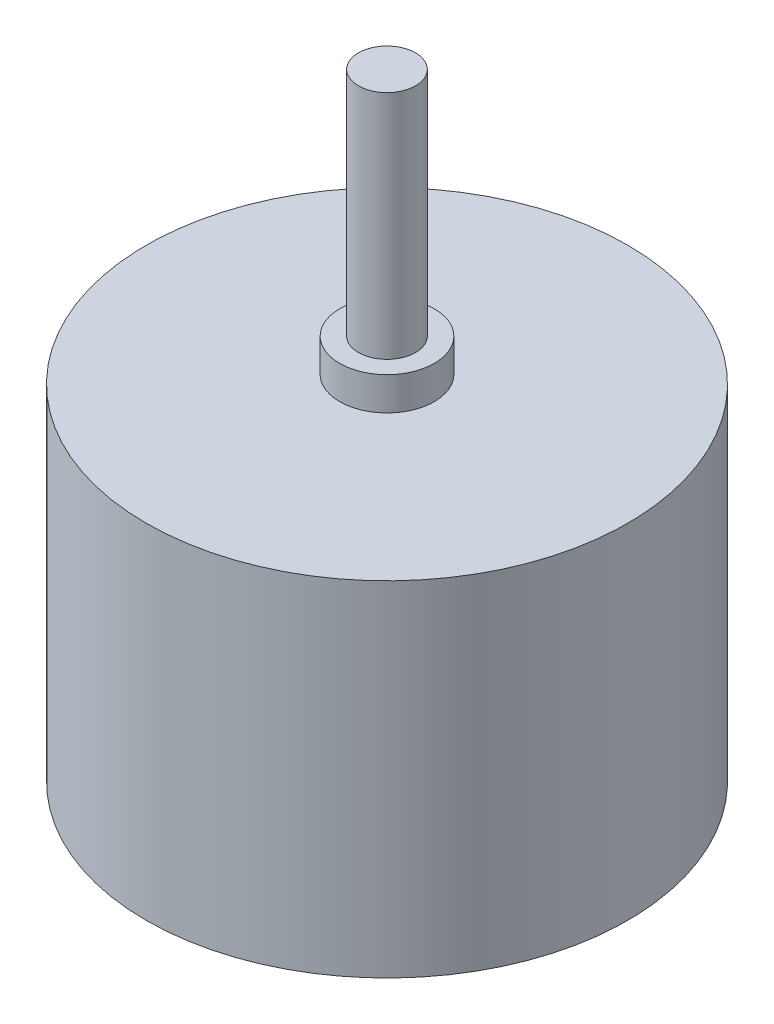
SolidWorks part; units mm, degrees
ref_plane "Front Plane" through (0, 0, 0) normal (0, 0, 1) x (1, 0, 0)
ref_plane "Top Plane" through (0, 0, 0) normal (0, 1, 0) x (1, 0, 0)
ref_plane "Right Plane" through (0, 0, 0) normal (1, 0, 0) x (0, 0, -1)
sketch "Sketch1" plane through (0, 0, 0) normal (0, 0, 1) x (1, 0, 0)
  line L0 (4.9657, 38.1) -> (44.45, 38.1)
  line L1 (44.45, 38.1) -> (44.45, -25.4)
  line L2 (44.45, -25.4) -> (6.1109, -25.4)
  line L3 (0, -44.45) -> (0, 88.4428)
  line L4 (0, 1.2038) -> (0, -49.7616) construction
  line L5 (44.45, 0) -> (44.45, 38.1) construction
  line L6 (-44.45, 38.1) -> (44.45, 38.1) construction
  line L7 (38.1254, -25.4) -> (-38.1254, -25.4) construction
  line L9 (4.9657, 38.1) -> (4.9657, 39.6748)
  line L11 (8.7312, 39.6748) -> (4.9657, 39.6748)
  line L13 (5.2705, 45.7962) -> (8.7312, 45.7962)
  line L15 (8.7312, 39.6748) -> (8.7312, 45.7962)
  line L17 (5.2705, 45.7962) -> (5.2705, 88.4428)
  line L19 (0, 88.4428) -> (5.2705, 88.4428)
  line L20 (5.5562, -44.45) -> (5.5562, -26.924) construction
  line L21 (5.5562, -44.45) -> (5.5562, -26.924)
  line L22 (5.5562, -26.924) -> (6.1109, -25.4) construction
  line L23 (5.5562, -26.924) -> (6.1109, -25.4)
  line L24 (5.5562, -44.45) -> (-5.5562, -44.45) construction
  line L25 (5.5562, -44.45) -> (0, -44.45)
revolve "Revolve1" add sketch "Sketch1" angle 360 about L4
